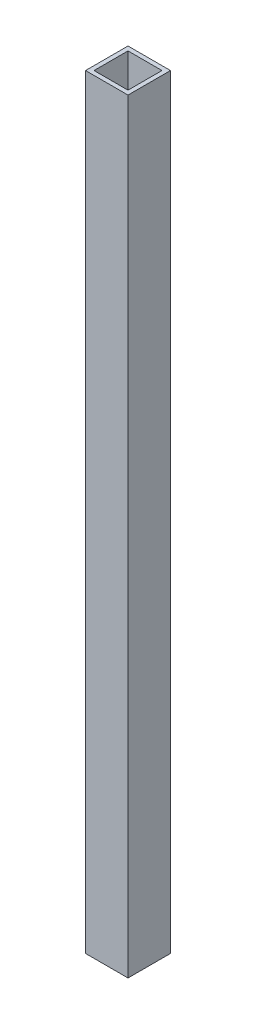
SolidWorks part; units mm, degrees
ref_plane "Plan de face" through (0, 0, 0) normal (0, 0, 1) x (1, 0, 0)
ref_plane "Plan de dessus" through (0, 0, 0) normal (0, 1, 0) x (1, 0, 0)
ref_plane "Plan de droite" through (0, 0, 0) normal (1, 0, 0) x (0, 0, -1)
sketch "Esquisse1" plane through (0, 0, 0) normal (0, 1, 0) x (1, 0, 0)
  line L1 (-5, 5) -> (5, 5)
  line L2 (-5, 5) -> (-5, -5)
  line L3 (-5, -5) -> (5, -5)
  line L4 (5, 5) -> (5, -5)
  line L5 (-5, 5) -> (5, -5) construction
  line L6 (-5, -5) -> (5, 5) construction
  line L7 (-4, 4) -> (4, 4)
  line L8 (-4, 4) -> (-4, -4)
  line L9 (-4, -4) -> (4, -4)
  line L10 (4, 4) -> (4, -4)
  line L11 (-4, 4) -> (4, -4) construction
  line L12 (-4, -4) -> (4, 4) construction
  point P0 (0, 0)
  point P5 (0, 0)
  dimension "D1" = 1
extrude "Boss.-Extru.1" add sketch "Esquisse1" along normal blind 180
